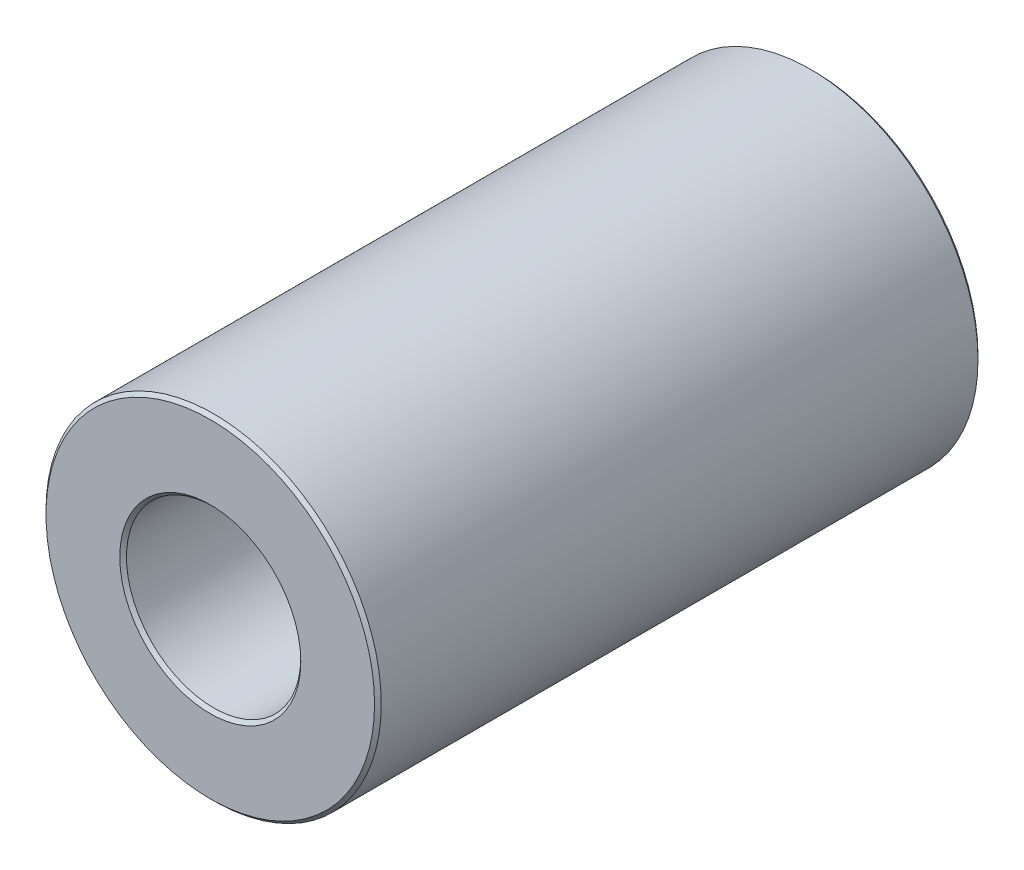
SolidWorks part; units mm, degrees
ref_plane "Front Plane" through (0, 0, 0) normal (0, 0, 1) x (1, 0, 0)
ref_plane "Top Plane" through (0, 0, 0) normal (0, 1, 0) x (1, 0, 0)
ref_plane "Right Plane" through (0, 0, 0) normal (1, 0, 0) x (0, 0, -1)
sketch "Sketch1" plane through (0, 0, 0) normal (0, 0, 1) x (1, 0, 0)
  circle A0 centre (0, 0) radius 5
  circle A1 centre (0, 0) radius 2.6
  dimension "D1" = 10
  dimension "D2" = 5.2
extrude "Boss-Extrude2" add sketch "Sketch1" along normal mid plane 18
chamfer "Chamfer3" distance 0.1 angle 45 4 edges at (5, 0, 9) (5, 0, -9) (2.6, 0, -9) (2.6, 0, 9)
